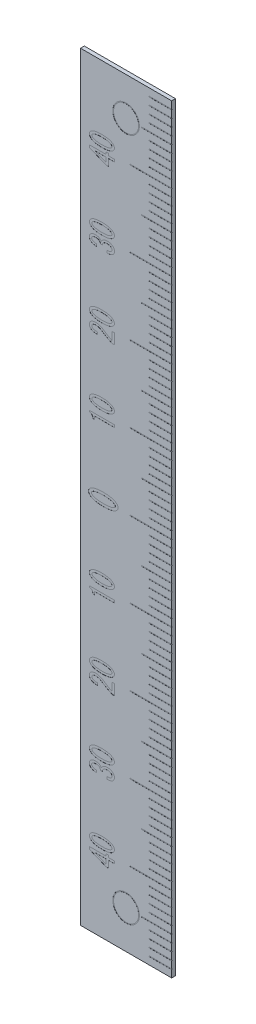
SolidWorks part; units mm, degrees
ref_plane "Front" through (0, 0, 0) normal (0, 0, 1) x (1, 0, 0)
ref_plane "Top" through (0, 0, 0) normal (0, 1, 0) x (1, 0, 0)
ref_plane "Right" through (0, 0, 0) normal (1, 0, 0) x (0, 0, -1)
sketch "Sketch1" plane through (0, 0, 0) normal (0, 0, 1) x (1, 0, 0)
  line L1 (0, 0) -> (0, 100)
  line L2 (0, 0) -> (12, 0)
  line L3 (12, 0) -> (12, 100)
  line L4 (0, 100) -> (12, 100)
  dimension "D1" = 100
  dimension "D2" = 12
extrude "Extrude1" add sketch "Sketch1" along normal blind 0.5
sketch "Sketch2" plane through (0, 0, 0.5) normal (0, 0, 1) x (1, 0, 0)
  line L0 (0, 100) -> (0, 0) construction
  line L1 (0, 0) -> (12, 0) construction
  line L2 (12, 100) -> (0, 100) construction
  circle A0 centre (6, 5) radius 1.75
  circle A1 centre (6, 95) radius 1.75
  circle A2 centre (6, 5) radius 1.65
  circle A3 centre (6, 95) radius 1.65
  dimension "D1" = 6
  dimension "D2" = 6
  dimension "D3" = 5
  dimension "D4" = 5
  dimension "D5" = 3.5
  dimension "D6" = 3.5
  dimension "D7" = 0.1
extrude "Extrude2" cut sketch "Sketch2" against normal blind 0.01
sketch "Sketch3" plane through (0, 0, 0.5) normal (0, 0, 1) x (1, 0, 0)
  line L0 (12, 100) -> (0, 100) construction
  line L1 (1, 88.25) -> (4.5, 88.25) construction
  line L2 (1, 88.25) -> (1, 91.75) construction
  line L3 (1, 91.75) -> (4.5, 91.75) construction
  line L4 (4.5, 88.25) -> (4.5, 91.75) construction
  line L5 (0, 100) -> (0, 0) construction
  line L6 (4.5, 78.25) -> (4.5, 81.75) construction
  line L7 (4.5, 68.25) -> (4.5, 71.75) construction
  line L8 (4.5, 58.25) -> (4.5, 61.75) construction
  line L9 (5, 49.125) -> (5, 52.625) construction
  line L10 (4.5, 38.25) -> (4.5, 41.75) construction
  line L11 (4.5, 28.25) -> (4.5, 31.75) construction
  line L12 (4.5, 18.25) -> (4.5, 21.75) construction
  line L13 (4.5, 8.25) -> (4.5, 11.75) construction
  line L14 (8.2751, 50) -> (-8.2751, 50) construction
  line L15 (8.2751, 40) -> (-8.2751, 40) construction
  line L16 (12, 0) -> (12, 100) construction
  line L17 (8.2751, 30) -> (-8.2751, 30) construction
  line L18 (8.2751, 20) -> (-8.2751, 20) construction
  line L19 (8.2751, 10) -> (-8.2751, 10) construction
  line L20 (8.2751, 60) -> (-8.2751, 60) construction
  line L21 (8.2751, 70) -> (-8.2751, 70) construction
  line L22 (8.2751, 80) -> (-8.2751, 80) construction
  line L23 (8.2751, 90) -> (-8.2751, 90) construction
  text T0 "40" font "ＭＳ ゴシック" height in points 11
  text T1 "30" font "ＭＳ ゴシック" height in points 11
  text T2 "20" font "ＭＳ ゴシック" height in points 11
  text T3 "10" font "ＭＳ ゴシック" height in points 11
  text T4 "0" font "ＭＳ ゴシック" height in points 13
  text T5 "10  " font "ＭＳ ゴシック" height in points 11
  text T6 "20" font "ＭＳ ゴシック" height in points 11
  text T7 "30" font "ＭＳ ゴシック" height in points 11
  text T8 "40" font "ＭＳ ゴシック" height in points 11
  point P4 (4.5, 90)
  point P36 (0, 50)
  dimension "D1" = 3.5
  dimension "D2" = 10
  dimension "D3" = 1
  dimension "D4" = 3.5
  dimension "D7" = 5
  dimension "D9" = 0.875
  dimension "D6" = 7
  dimension "D5" = 4
  dimension "D8" = 5
extrude "Extrude3" cut sketch "Sketch3" against normal blind 0.01
sketch "Sketch4" plane through (0, 0, 0.5) normal (0, 0, 1) x (1, 0, 0)
  line L0 (12, 90.05) -> (6.5, 90.05)
  line L1 (12, 0) -> (12, 100) construction
  line L2 (6.5, 90.05) -> (6.5, 89.95)
  line L3 (6.5, 89.95) -> (12, 89.95)
  line L4 (12, 89.95) -> (12, 90.05)
  line L5 (12, 100) -> (0, 100) construction
  line L6 (12, 98.05) -> (12, 97.95)
  line L7 (12, 94.95) -> (8, 94.95)
  line L8 (12, 94.95) -> (12, 95.05)
  line L9 (12, 95.05) -> (8, 95.05)
  line L10 (8, 94.95) -> (8, 95.05)
  line L11 (12, 99.05) -> (9, 99.05)
  line L12 (12, 99.05) -> (12, 98.95)
  line L13 (12, 98.95) -> (9, 98.95)
  line L14 (9, 99.05) -> (9, 98.95)
  line L15 (12, 98.05) -> (9, 98.05)
  line L16 (12, 97.95) -> (9, 97.95)
  line L17 (9, 98.05) -> (9, 97.95)
  line L18 (12, 97.05) -> (12, 96.95)
  line L19 (12, 97.05) -> (9, 97.05)
  line L20 (12, 96.95) -> (9, 96.95)
  line L21 (9, 97.05) -> (9, 96.95)
  line L22 (12, 96.05) -> (12, 95.95)
  line L23 (12, 96.05) -> (9, 96.05)
  line L24 (12, 95.95) -> (9, 95.95)
  line L25 (9, 96.05) -> (9, 95.95)
  line L26 (12, 80.05) -> (6.5, 80.05)
  line L27 (6.5, 80.05) -> (6.5, 79.95)
  line L28 (6.5, 79.95) -> (12, 79.95)
  line L29 (12, 79.95) -> (12, 80.05)
  line L30 (12, 94.05) -> (12, 93.95)
  line L31 (12, 94.05) -> (9, 94.05)
  line L32 (12, 93.95) -> (9, 93.95)
  line L33 (9, 94.05) -> (9, 93.95)
  line L34 (12, 93.05) -> (12, 92.95)
  line L35 (12, 93.05) -> (9, 93.05)
  line L36 (12, 92.95) -> (9, 92.95)
  line L37 (9, 93.05) -> (9, 92.95)
  line L38 (12, 92.05) -> (12, 91.95)
  line L39 (12, 92.05) -> (9, 92.05)
  line L40 (12, 91.95) -> (9, 91.95)
  line L41 (9, 92.05) -> (9, 91.95)
  line L42 (12, 91.05) -> (12, 90.95)
  line L43 (12, 91.05) -> (9, 91.05)
  line L44 (12, 90.95) -> (9, 90.95)
  line L45 (9, 91.05) -> (9, 90.95)
  line L46 (9, 95.05) -> (9, 94.95)
  line L47 (12, 95.05) -> (9, 95.05)
  line L48 (12, 94.95) -> (9, 94.95)
  line L49 (12, 95.05) -> (12, 94.95)
  line L50 (12, 88.05) -> (12, 87.95)
  line L51 (12, 84.95) -> (8, 84.95)
  line L52 (12, 84.95) -> (12, 85.05)
  line L53 (12, 85.05) -> (8, 85.05)
  line L54 (8, 84.95) -> (8, 85.05)
  line L55 (12, 89.05) -> (9, 89.05)
  line L56 (12, 89.05) -> (12, 88.95)
  line L57 (12, 88.95) -> (9, 88.95)
  line L58 (9, 89.05) -> (9, 88.95)
  line L59 (12, 88.05) -> (9, 88.05)
  line L60 (12, 87.95) -> (9, 87.95)
  line L61 (9, 88.05) -> (9, 87.95)
  line L62 (12, 87.05) -> (12, 86.95)
  line L63 (12, 87.05) -> (9, 87.05)
  line L64 (12, 86.95) -> (9, 86.95)
  line L65 (9, 87.05) -> (9, 86.95)
  line L66 (12, 86.05) -> (12, 85.95)
  line L67 (12, 86.05) -> (9, 86.05)
  line L68 (12, 85.95) -> (9, 85.95)
  line L69 (9, 86.05) -> (9, 85.95)
  line L70 (12, 84.05) -> (12, 83.95)
  line L71 (12, 84.05) -> (9, 84.05)
  line L72 (12, 83.95) -> (9, 83.95)
  line L73 (9, 84.05) -> (9, 83.95)
  line L74 (12, 83.05) -> (12, 82.95)
  line L75 (12, 83.05) -> (9, 83.05)
  line L76 (12, 82.95) -> (9, 82.95)
  line L77 (9, 83.05) -> (9, 82.95)
  line L78 (12, 82.05) -> (12, 81.95)
  line L79 (12, 82.05) -> (9, 82.05)
  line L80 (12, 81.95) -> (9, 81.95)
  line L81 (9, 82.05) -> (9, 81.95)
  line L82 (12, 81.05) -> (12, 80.95)
  line L83 (12, 81.05) -> (9, 81.05)
  line L84 (12, 80.95) -> (9, 80.95)
  line L85 (9, 81.05) -> (9, 80.95)
  line L86 (12, 70.05) -> (6.5, 70.05)
  line L87 (6.5, 70.05) -> (6.5, 69.95)
  line L88 (6.5, 69.95) -> (12, 69.95)
  line L89 (12, 69.95) -> (12, 70.05)
  line L90 (12, 78.05) -> (12, 77.95)
  line L91 (12, 74.95) -> (8, 74.95)
  line L92 (12, 74.95) -> (12, 75.05)
  line L93 (12, 75.05) -> (8, 75.05)
  line L94 (8, 74.95) -> (8, 75.05)
  line L95 (12, 79.05) -> (9, 79.05)
  line L96 (12, 79.05) -> (12, 78.95)
  line L97 (12, 78.95) -> (9, 78.95)
  line L98 (9, 79.05) -> (9, 78.95)
  line L99 (12, 78.05) -> (9, 78.05)
  line L100 (12, 77.95) -> (9, 77.95)
  line L101 (9, 78.05) -> (9, 77.95)
  line L102 (12, 77.05) -> (12, 76.95)
  line L103 (12, 77.05) -> (9, 77.05)
  line L104 (12, 76.95) -> (9, 76.95)
  line L105 (9, 77.05) -> (9, 76.95)
  line L106 (12, 76.05) -> (12, 75.95)
  line L107 (12, 76.05) -> (9, 76.05)
  line L108 (12, 75.95) -> (9, 75.95)
  line L109 (9, 76.05) -> (9, 75.95)
  line L110 (12, 74.05) -> (12, 73.95)
  line L111 (12, 74.05) -> (9, 74.05)
  line L112 (12, 73.95) -> (9, 73.95)
  line L113 (9, 74.05) -> (9, 73.95)
  line L114 (12, 73.05) -> (12, 72.95)
  line L115 (12, 73.05) -> (9, 73.05)
  line L116 (12, 72.95) -> (9, 72.95)
  line L117 (9, 73.05) -> (9, 72.95)
  line L118 (12, 72.05) -> (12, 71.95)
  line L119 (12, 72.05) -> (9, 72.05)
  line L120 (12, 71.95) -> (9, 71.95)
  line L121 (9, 72.05) -> (9, 71.95)
  line L122 (12, 71.05) -> (12, 70.95)
  line L123 (12, 71.05) -> (9, 71.05)
  line L124 (12, 70.95) -> (9, 70.95)
  line L125 (9, 71.05) -> (9, 70.95)
  line L126 (12, 60.05) -> (6.5, 60.05)
  line L127 (6.5, 60.05) -> (6.5, 59.95)
  line L128 (6.5, 59.95) -> (12, 59.95)
  line L129 (12, 59.95) -> (12, 60.05)
  line L130 (12, 68.05) -> (12, 67.95)
  line L131 (12, 64.95) -> (8, 64.95)
  line L132 (12, 64.95) -> (12, 65.05)
  line L133 (12, 65.05) -> (8, 65.05)
  line L134 (8, 64.95) -> (8, 65.05)
  line L135 (12, 69.05) -> (9, 69.05)
  line L136 (12, 69.05) -> (12, 68.95)
  line L137 (12, 68.95) -> (9, 68.95)
  line L138 (9, 69.05) -> (9, 68.95)
  line L139 (12, 68.05) -> (9, 68.05)
  line L140 (12, 67.95) -> (9, 67.95)
  line L141 (9, 68.05) -> (9, 67.95)
  line L142 (12, 67.05) -> (12, 66.95)
  line L143 (12, 67.05) -> (9, 67.05)
  line L144 (12, 66.95) -> (9, 66.95)
  line L145 (9, 67.05) -> (9, 66.95)
  line L146 (12, 66.05) -> (12, 65.95)
  line L147 (12, 66.05) -> (9, 66.05)
  line L148 (12, 65.95) -> (9, 65.95)
  line L149 (9, 66.05) -> (9, 65.95)
  line L150 (12, 64.05) -> (12, 63.95)
  line L151 (12, 64.05) -> (9, 64.05)
  line L152 (12, 63.95) -> (9, 63.95)
  line L153 (9, 64.05) -> (9, 63.95)
  line L154 (12, 63.05) -> (12, 62.95)
  line L155 (12, 63.05) -> (9, 63.05)
  line L156 (12, 62.95) -> (9, 62.95)
  line L157 (9, 63.05) -> (9, 62.95)
  line L158 (12, 62.05) -> (12, 61.95)
  line L159 (12, 62.05) -> (9, 62.05)
  line L160 (12, 61.95) -> (9, 61.95)
  line L161 (9, 62.05) -> (9, 61.95)
  line L162 (12, 61.05) -> (12, 60.95)
  line L163 (12, 61.05) -> (9, 61.05)
  line L164 (12, 60.95) -> (9, 60.95)
  line L165 (9, 61.05) -> (9, 60.95)
  line L166 (12, 50.05) -> (6.5, 50.05)
  line L167 (6.5, 50.05) -> (6.5, 49.95)
  line L168 (6.5, 49.95) -> (12, 49.95)
  line L169 (12, 49.95) -> (12, 50.05)
  line L170 (12, 58.05) -> (12, 57.95)
  line L171 (12, 54.95) -> (8, 54.95)
  line L172 (12, 54.95) -> (12, 55.05)
  line L173 (12, 55.05) -> (8, 55.05)
  line L174 (8, 54.95) -> (8, 55.05)
  line L175 (12, 59.05) -> (9, 59.05)
  line L176 (12, 59.05) -> (12, 58.95)
  line L177 (12, 58.95) -> (9, 58.95)
  line L178 (9, 59.05) -> (9, 58.95)
  line L179 (12, 58.05) -> (9, 58.05)
  line L180 (12, 57.95) -> (9, 57.95)
  line L181 (9, 58.05) -> (9, 57.95)
  line L182 (12, 57.05) -> (12, 56.95)
  line L183 (12, 57.05) -> (9, 57.05)
  line L184 (12, 56.95) -> (9, 56.95)
  line L185 (9, 57.05) -> (9, 56.95)
  line L186 (12, 56.05) -> (12, 55.95)
  line L187 (12, 56.05) -> (9, 56.05)
  line L188 (12, 55.95) -> (9, 55.95)
  line L189 (9, 56.05) -> (9, 55.95)
  line L190 (12, 54.05) -> (12, 53.95)
  line L191 (12, 54.05) -> (9, 54.05)
  line L192 (12, 53.95) -> (9, 53.95)
  line L193 (9, 54.05) -> (9, 53.95)
  line L194 (12, 53.05) -> (12, 52.95)
  line L195 (12, 53.05) -> (9, 53.05)
  line L196 (12, 52.95) -> (9, 52.95)
  line L197 (9, 53.05) -> (9, 52.95)
  line L198 (12, 52.05) -> (12, 51.95)
  line L199 (12, 52.05) -> (9, 52.05)
  line L200 (12, 51.95) -> (9, 51.95)
  line L201 (9, 52.05) -> (9, 51.95)
  line L202 (12, 51.05) -> (12, 50.95)
  line L203 (12, 51.05) -> (9, 51.05)
  line L204 (12, 50.95) -> (9, 50.95)
  line L205 (9, 51.05) -> (9, 50.95)
  line L206 (12, 50.05) -> (6.5, 50.05)
  line L207 (6.5, 50.05) -> (6.5, 49.95)
  line L208 (6.5, 49.95) -> (12, 49.95)
  line L209 (12, 49.95) -> (12, 50.05)
  line L210 (12, 48.05) -> (12, 47.95)
  line L211 (12, 44.95) -> (8, 44.95)
  line L212 (12, 44.95) -> (12, 45.05)
  line L213 (12, 45.05) -> (8, 45.05)
  line L214 (8, 44.95) -> (8, 45.05)
  line L215 (12, 49.05) -> (9, 49.05)
  line L216 (12, 49.05) -> (12, 48.95)
  line L217 (12, 48.95) -> (9, 48.95)
  line L218 (9, 49.05) -> (9, 48.95)
  line L219 (12, 48.05) -> (9, 48.05)
  line L220 (12, 47.95) -> (9, 47.95)
  line L221 (9, 48.05) -> (9, 47.95)
  line L222 (12, 47.05) -> (12, 46.95)
  line L223 (12, 47.05) -> (9, 47.05)
  line L224 (12, 46.95) -> (9, 46.95)
  line L225 (9, 47.05) -> (9, 46.95)
  line L226 (12, 46.05) -> (12, 45.95)
  line L227 (12, 46.05) -> (9, 46.05)
  line L228 (12, 45.95) -> (9, 45.95)
  line L229 (9, 46.05) -> (9, 45.95)
  line L230 (12, 44.05) -> (12, 43.95)
  line L231 (12, 44.05) -> (9, 44.05)
  line L232 (12, 43.95) -> (9, 43.95)
  line L233 (9, 44.05) -> (9, 43.95)
  line L234 (12, 43.05) -> (12, 42.95)
  line L235 (12, 43.05) -> (9, 43.05)
  line L236 (12, 42.95) -> (9, 42.95)
  line L237 (9, 43.05) -> (9, 42.95)
  line L238 (12, 42.05) -> (12, 41.95)
  line L239 (12, 42.05) -> (9, 42.05)
  line L240 (12, 41.95) -> (9, 41.95)
  line L241 (9, 42.05) -> (9, 41.95)
  line L242 (12, 41.05) -> (12, 40.95)
  line L243 (12, 41.05) -> (9, 41.05)
  line L244 (12, 40.95) -> (9, 40.95)
  line L245 (9, 41.05) -> (9, 40.95)
  line L246 (12, 40.05) -> (6.5, 40.05)
  line L247 (6.5, 40.05) -> (6.5, 39.95)
  line L248 (6.5, 39.95) -> (12, 39.95)
  line L249 (12, 39.95) -> (12, 40.05)
  line L250 (12, 38.05) -> (12, 37.95)
  line L251 (12, 34.95) -> (8, 34.95)
  line L252 (12, 34.95) -> (12, 35.05)
  line L253 (12, 35.05) -> (8, 35.05)
  line L254 (8, 34.95) -> (8, 35.05)
  line L255 (12, 39.05) -> (9, 39.05)
  line L256 (12, 39.05) -> (12, 38.95)
  line L257 (12, 38.95) -> (9, 38.95)
  line L258 (9, 39.05) -> (9, 38.95)
  line L259 (12, 38.05) -> (9, 38.05)
  line L260 (12, 37.95) -> (9, 37.95)
  line L261 (9, 38.05) -> (9, 37.95)
  line L262 (12, 37.05) -> (12, 36.95)
  line L263 (12, 37.05) -> (9, 37.05)
  line L264 (12, 36.95) -> (9, 36.95)
  line L265 (9, 37.05) -> (9, 36.95)
  line L266 (12, 36.05) -> (12, 35.95)
  line L267 (12, 36.05) -> (9, 36.05)
  line L268 (12, 35.95) -> (9, 35.95)
  line L269 (9, 36.05) -> (9, 35.95)
  line L270 (12, 34.05) -> (12, 33.95)
  line L271 (12, 34.05) -> (9, 34.05)
  line L272 (12, 33.95) -> (9, 33.95)
  line L273 (9, 34.05) -> (9, 33.95)
  line L274 (12, 33.05) -> (12, 32.95)
  line L275 (12, 33.05) -> (9, 33.05)
  line L276 (12, 32.95) -> (9, 32.95)
  line L277 (9, 33.05) -> (9, 32.95)
  line L278 (12, 32.05) -> (12, 31.95)
  line L279 (12, 32.05) -> (9, 32.05)
  line L280 (12, 31.95) -> (9, 31.95)
  line L281 (9, 32.05) -> (9, 31.95)
  line L282 (12, 31.05) -> (12, 30.95)
  line L283 (12, 31.05) -> (9, 31.05)
  line L284 (12, 30.95) -> (9, 30.95)
  line L285 (9, 31.05) -> (9, 30.95)
  line L286 (12, 30.05) -> (6.5, 30.05)
  line L287 (6.5, 30.05) -> (6.5, 29.95)
  line L288 (6.5, 29.95) -> (12, 29.95)
  line L289 (12, 29.95) -> (12, 30.05)
  line L290 (12, 28.05) -> (12, 27.95)
  line L291 (12, 24.95) -> (8, 24.95)
  line L292 (12, 24.95) -> (12, 25.05)
  line L293 (12, 25.05) -> (8, 25.05)
  line L294 (8, 24.95) -> (8, 25.05)
  line L295 (12, 29.05) -> (9, 29.05)
  line L296 (12, 29.05) -> (12, 28.95)
  line L297 (12, 28.95) -> (9, 28.95)
  line L298 (9, 29.05) -> (9, 28.95)
  line L299 (12, 28.05) -> (9, 28.05)
  line L300 (12, 27.95) -> (9, 27.95)
  line L301 (9, 28.05) -> (9, 27.95)
  line L302 (12, 27.05) -> (12, 26.95)
  line L303 (12, 27.05) -> (9, 27.05)
  line L304 (12, 26.95) -> (9, 26.95)
  line L305 (9, 27.05) -> (9, 26.95)
  line L306 (12, 26.05) -> (12, 25.95)
  line L307 (12, 26.05) -> (9, 26.05)
  line L308 (12, 25.95) -> (9, 25.95)
  line L309 (9, 26.05) -> (9, 25.95)
  line L310 (12, 24.05) -> (12, 23.95)
  line L311 (12, 24.05) -> (9, 24.05)
  line L312 (12, 23.95) -> (9, 23.95)
  line L313 (9, 24.05) -> (9, 23.95)
  line L314 (12, 23.05) -> (12, 22.95)
  line L315 (12, 23.05) -> (9, 23.05)
  line L316 (12, 22.95) -> (9, 22.95)
  line L317 (9, 23.05) -> (9, 22.95)
  line L318 (12, 22.05) -> (12, 21.95)
  line L319 (12, 22.05) -> (9, 22.05)
  line L320 (12, 21.95) -> (9, 21.95)
  line L321 (9, 22.05) -> (9, 21.95)
  line L322 (12, 21.05) -> (12, 20.95)
  line L323 (12, 21.05) -> (9, 21.05)
  line L324 (12, 20.95) -> (9, 20.95)
  line L325 (9, 21.05) -> (9, 20.95)
  line L326 (12, 20.05) -> (6.5, 20.05)
  line L327 (6.5, 20.05) -> (6.5, 19.95)
  line L328 (6.5, 19.95) -> (12, 19.95)
  line L329 (12, 19.95) -> (12, 20.05)
  line L330 (12, 18.05) -> (12, 17.95)
  line L331 (12, 14.95) -> (8, 14.95)
  line L332 (12, 14.95) -> (12, 15.05)
  line L333 (12, 15.05) -> (8, 15.05)
  line L334 (8, 14.95) -> (8, 15.05)
  line L335 (12, 19.05) -> (9, 19.05)
  line L336 (12, 19.05) -> (12, 18.95)
  line L337 (12, 18.95) -> (9, 18.95)
  line L338 (9, 19.05) -> (9, 18.95)
  line L339 (12, 18.05) -> (9, 18.05)
  line L340 (12, 17.95) -> (9, 17.95)
  line L341 (9, 18.05) -> (9, 17.95)
  line L342 (12, 17.05) -> (12, 16.95)
  line L343 (12, 17.05) -> (9, 17.05)
  line L344 (12, 16.95) -> (9, 16.95)
  line L345 (9, 17.05) -> (9, 16.95)
  line L346 (12, 16.05) -> (12, 15.95)
  line L347 (12, 16.05) -> (9, 16.05)
  line L348 (12, 15.95) -> (9, 15.95)
  line L349 (9, 16.05) -> (9, 15.95)
  line L350 (12, 14.05) -> (12, 13.95)
  line L351 (12, 14.05) -> (9, 14.05)
  line L352 (12, 13.95) -> (9, 13.95)
  line L353 (9, 14.05) -> (9, 13.95)
  line L354 (12, 13.05) -> (12, 12.95)
  line L355 (12, 13.05) -> (9, 13.05)
  line L356 (12, 12.95) -> (9, 12.95)
  line L357 (9, 13.05) -> (9, 12.95)
  line L358 (12, 12.05) -> (12, 11.95)
  line L359 (12, 12.05) -> (9, 12.05)
  line L360 (12, 11.95) -> (9, 11.95)
  line L361 (9, 12.05) -> (9, 11.95)
  line L362 (12, 11.05) -> (12, 10.95)
  line L363 (12, 11.05) -> (9, 11.05)
  line L364 (12, 10.95) -> (9, 10.95)
  line L365 (9, 11.05) -> (9, 10.95)
  line L366 (12, 10.05) -> (6.5, 10.05)
  line L367 (6.5, 10.05) -> (6.5, 9.95)
  line L368 (6.5, 9.95) -> (12, 9.95)
  line L369 (12, 9.95) -> (12, 10.05)
  line L370 (12, 8.05) -> (12, 7.95)
  line L371 (12, 4.95) -> (8, 4.95)
  line L372 (12, 4.95) -> (12, 5.05)
  line L373 (12, 5.05) -> (8, 5.05)
  line L374 (8, 4.95) -> (8, 5.05)
  line L375 (12, 9.05) -> (9, 9.05)
  line L376 (12, 9.05) -> (12, 8.95)
  line L377 (12, 8.95) -> (9, 8.95)
  line L378 (9, 9.05) -> (9, 8.95)
  line L379 (12, 8.05) -> (9, 8.05)
  line L380 (12, 7.95) -> (9, 7.95)
  line L381 (9, 8.05) -> (9, 7.95)
  line L382 (12, 7.05) -> (12, 6.95)
  line L383 (12, 7.05) -> (9, 7.05)
  line L384 (12, 6.95) -> (9, 6.95)
  line L385 (9, 7.05) -> (9, 6.95)
  line L386 (12, 6.05) -> (12, 5.95)
  line L387 (12, 6.05) -> (9, 6.05)
  line L388 (12, 5.95) -> (9, 5.95)
  line L389 (9, 6.05) -> (9, 5.95)
  line L390 (12, 4.05) -> (12, 3.95)
  line L391 (12, 4.05) -> (9, 4.05)
  line L392 (12, 3.95) -> (9, 3.95)
  line L393 (9, 4.05) -> (9, 3.95)
  line L394 (12, 3.05) -> (12, 2.95)
  line L395 (12, 3.05) -> (9, 3.05)
  line L396 (12, 2.95) -> (9, 2.95)
  line L397 (9, 3.05) -> (9, 2.95)
  line L398 (12, 2.05) -> (12, 1.95)
  line L399 (12, 2.05) -> (9, 2.05)
  line L400 (12, 1.95) -> (9, 1.95)
  line L401 (9, 2.05) -> (9, 1.95)
  line L402 (12, 1.05) -> (12, 0.95)
  line L403 (12, 1.05) -> (9, 1.05)
  line L404 (12, 0.95) -> (9, 0.95)
  line L405 (9, 1.05) -> (9, 0.95)
  point P4 (12, 90)
  point P13 (12, 95)
  point P18 (12, 99)
  dimension "D1" = 10
  dimension "D2" = 0.1
  dimension "D3" = 5.5
  dimension "D4" = 5
  dimension "D5" = 0.1
  dimension "D6" = 1
  dimension "D7" = 0.1
  dimension "D8" = 3
  dimension "D9" = 4
  dimension "D10" = 9
  dimension "D11" = 5
  dimension "D12" = 6
extrude "Extrude4" cut sketch "Sketch4" against normal blind 0.01
move or copy body "Body-Move/Copy2" bodies to move or copy 105 copy no translate (-12, -50, 0)
